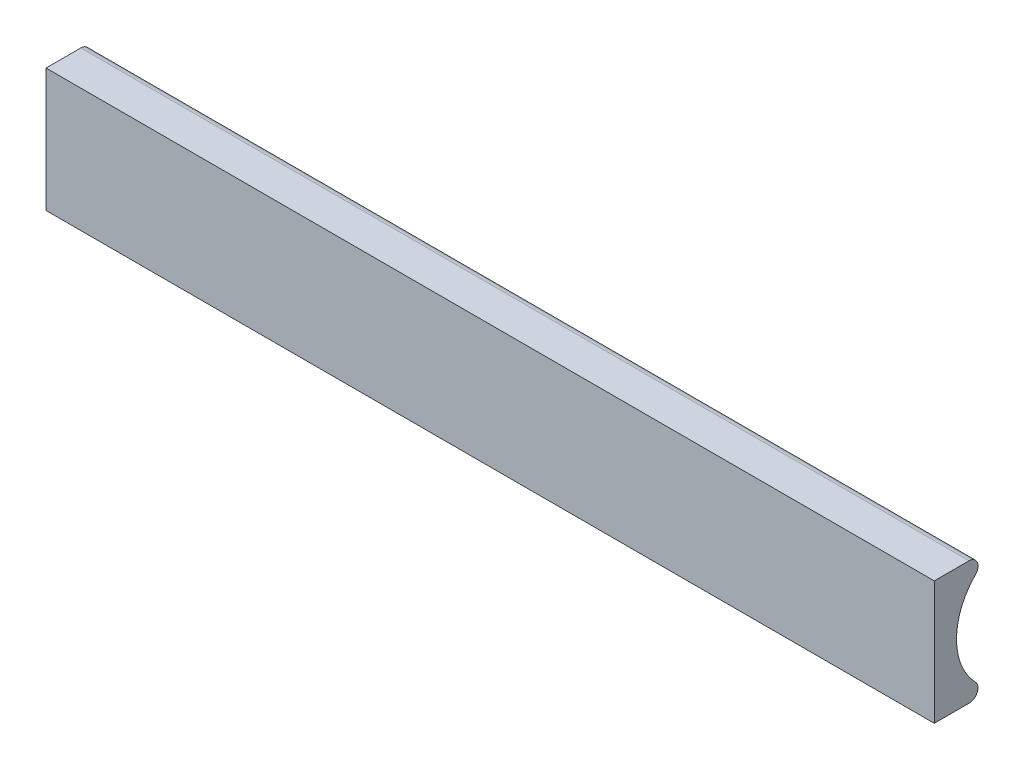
SolidWorks part; units mm, degrees
ref_plane "Спереди" through (0, 0, 0) normal (0, 0, 1) x (1, 0, 0)
ref_plane "Сверху" through (0, 0, 0) normal (0, 1, 0) x (1, 0, 0)
ref_plane "Справа" through (0, 0, 0) normal (1, 0, 0) x (0, 0, -1)
sketch "Эскиз1" plane through (0, 0, 0) normal (0, 0, 1) x (1, 0, 0)
  line L0 (-14, -1.3887) -> (6, -1.3887) construction
  line L1 (6, -1.3887) -> (6, 1.3887) construction
  line L2 (6, 1.3887) -> (-14, 1.3887) construction
  line L3 (-14, 1.3887) -> (-14, -1.3887) construction
  line L4 (-14, -1.3887) -> (6, -1.3887)
  line L5 (6, -1.3887) -> (6, 1.3887)
  line L6 (6, 1.3887) -> (-14, 1.3887)
  line L7 (-14, 1.3887) -> (-14, -1.3887)
extrude "Бобышка-Вытянуть1" add sketch "Эскиз1" against normal blind 2
sketch "Эскиз2" plane through (-14, 0, 0) normal (-1, 0, 0) x (0, 0, 1)
  circle A0 centre (-2, 0) radius 1.5 construction
  circle A1 centre (-2, 0) radius 1.5
extrude "Вырез-Вытянуть1" cut sketch "Эскиз2" against normal through all
fillet "Скругление1" radius 0.2 2 edges at (-4, -1.3887, -1.4331) (-4, 1.3887, -1.4331)
